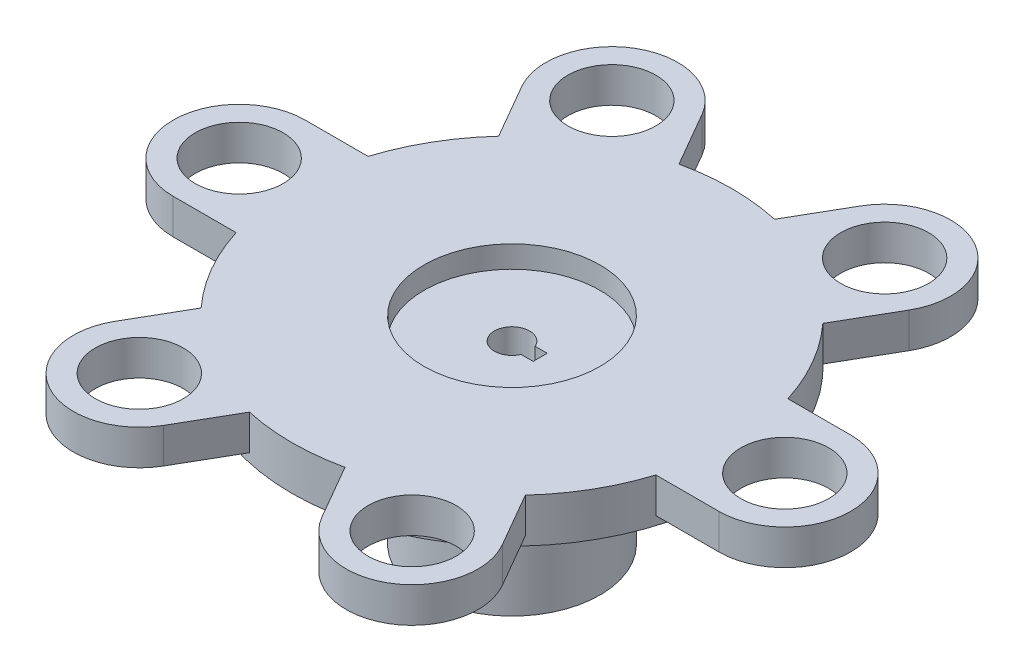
SolidWorks part; units mm, degrees
ref_plane "前视基准面" through (0, 0, 0) normal (0, 0, 1) x (1, 0, 0)
ref_plane "上视基准面" through (0, 0, 0) normal (0, 1, 0) x (1, 0, 0)
ref_plane "右视基准面" through (0, 0, 0) normal (1, 0, 0) x (0, 0, -1)
other "Configuration Table"
sketch "草图1" plane through (0, 0, 0) normal (0, 1, 0) x (1, 0, 0)
  circle A0 centre (0, 0) radius 10
  circle A1 centre (0, 0) radius 2
  dimension "D1" = 20
  dimension "D2" = 4
extrude "凸台-拉伸1" add sketch "草图1" along normal mid plane 20
sketch "草图2" plane through (0, 10, 0) normal (0, 1, 0) x (1, 0, 0)
  line L0 (0, 0) -> (4.544, 0) construction
  line L2 (1.5979, 0.8) -> (3.2, 0.8)
  line L3 (1.5979, 0.8) -> (1.5979, -0.8)
  line L4 (1.5979, -0.8) -> (3.2, -0.8)
  line L5 (3.2, 0.8) -> (3.2, -0.8)
  line L6 (1.5979, 0.8) -> (3.2, -0.8) construction
  line L7 (1.5979, -0.8) -> (3.2, 0.8) construction
  point P3 (2.3989, 0)
  dimension "D1" = 3.2
  dimension "D2" = 1.6
extrude "切除-拉伸1" cut sketch "草图2" against normal blind 30
sketch "草图3" plane through (0, 10, 0) normal (0, 1, 0) x (1, 0, 0)
  circle A0 centre (0, 0) radius 25
  circle A1 centre (0, 0) radius 10
extrude "凸台-拉伸2" add sketch "草图3" along normal mid plane 5
sketch "草图4" plane through (0, 12.5, 0) normal (0, 1, 0) x (1, 0, 0)
  line L0 (0, 0) -> (31, 0) construction
  line L1 (0, 0) -> (0, 27.3949) construction
  line L2 (31, 7.5) -> (19.3699, 7.5)
  line L3 (31, -7.5) -> (19.3699, -7.5)
  line L4 (19.3699, -7.5) -> (19.3699, 7.5)
  line L5 (9.0048, -30.5968) -> (3.1898, -20.5248)
  line L6 (3.1898, -20.5248) -> (16.1801, -13.0248)
  line L7 (21.9952, -23.0968) -> (16.1801, -13.0248)
  line L8 (-21.9952, -23.0968) -> (-16.1801, -13.0248)
  line L9 (-16.1801, -13.0248) -> (-3.1898, -20.5248)
  line L10 (-9.0048, -30.5968) -> (-3.1898, -20.5248)
  line L11 (-31, 7.5) -> (-19.3699, 7.5)
  line L12 (-19.3699, 7.5) -> (-19.3699, -7.5)
  line L13 (-31, -7.5) -> (-19.3699, -7.5)
  line L14 (-9.0048, 30.5968) -> (-3.1898, 20.5248)
  line L15 (-3.1898, 20.5248) -> (-16.1801, 13.0248)
  line L16 (-21.9952, 23.0968) -> (-16.1801, 13.0248)
  line L17 (21.9952, 23.0968) -> (16.1801, 13.0248)
  line L18 (16.1801, 13.0248) -> (3.1898, 20.5248)
  line L19 (9.0048, 30.5968) -> (3.1898, 20.5248)
  arc A0 (31, -7.5) -> (31, 7.5) centre (31, 0) ccw
  arc A1 (9.0048, -30.5968) -> (21.9952, -23.0968) centre (15.5, -26.8468) ccw
  circle A2 centre (0, 0) radius 31 construction
  arc A3 (-21.9952, -23.0968) -> (-9.0048, -30.5968) centre (-15.5, -26.8468) ccw
  arc A4 (-31, 7.5) -> (-31, -7.5) centre (-31, 0) ccw
  arc A5 (-9.0048, 30.5968) -> (-21.9952, 23.0968) centre (-15.5, 26.8468) ccw
  arc A6 (21.9952, 23.0968) -> (9.0048, 30.5968) centre (15.5, 26.8468) ccw
  point P1 (0, 0)
  point P5 (0, 0)
  point P51 (0, 0)
  dimension "D3" = 6
extrude "凸台-拉伸3" add sketch "草图4" against normal blind 4
sketch "草图5" plane through (0, 12.5, 0) normal (0, 1, 0) x (1, 0, 0)
  line L0 (0, 0) -> (19.25, -33.342) construction
  circle A0 centre (15.5, -26.8468) radius 5
  circle A1 centre (0, 0) radius 31 construction
  arc A3 (9.0048, -30.5968) -> (21.9952, -23.0968) centre (15.5, -26.8468) ccw construction
  circle A4 centre (-15.5, -26.8468) radius 5
  circle A5 centre (-31, 0) radius 5
  circle A6 centre (-15.5, 26.8468) radius 5
  circle A7 centre (15.5, 26.8468) radius 5
  circle A8 centre (31, 0) radius 5
  point P3 (0, 0)
  point P7 (0, 0)
  point P21 (0, 0)
  dimension "D1" = 10
  dimension "D2" = 62
  dimension "D3" = 6
extrude "切除-拉伸2" cut sketch "草图5" against normal blind 8
